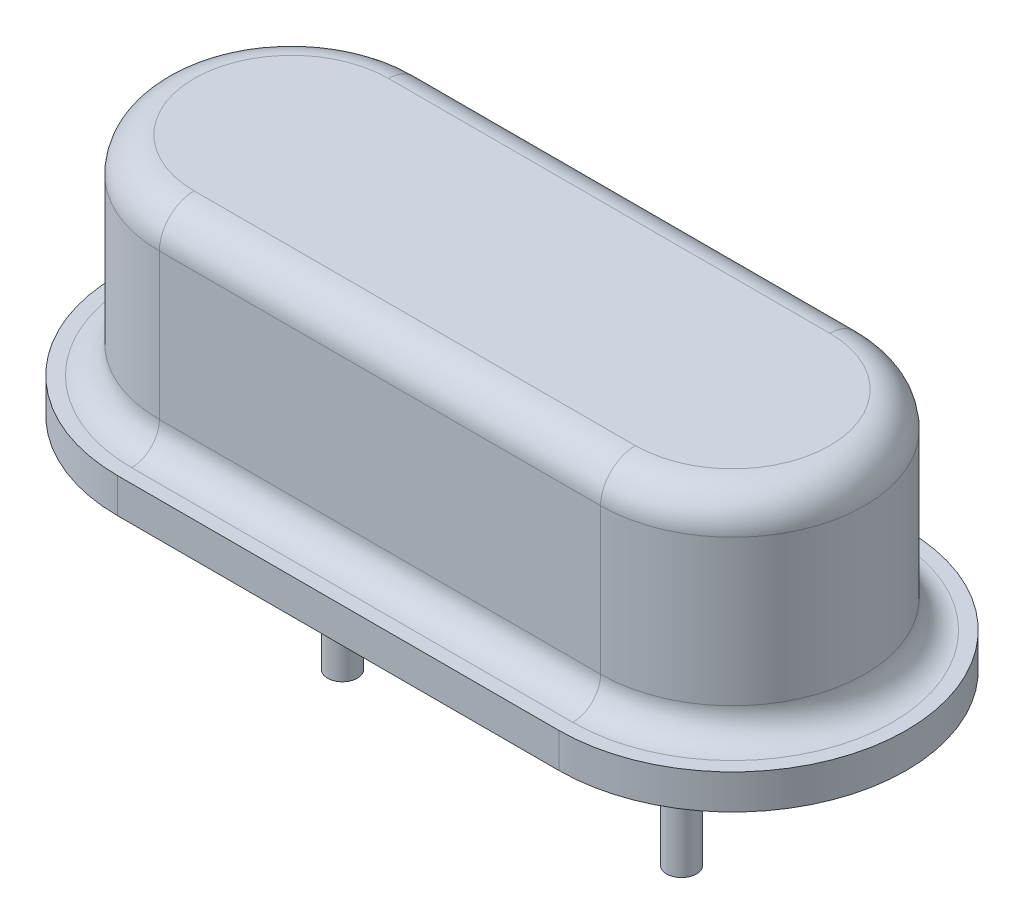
SolidWorks part; units mm, degrees
ref_plane "Front" through (0, 0, 0) normal (0, 0, 1) x (1, 0, 0)
ref_plane "Top" through (0, 0, 0) normal (0, 1, 0) x (1, 0, 0)
ref_plane "Right" through (0, 0, 0) normal (1, 0, 0) x (0, 0, -1)
sketch "Эскиз2" plane through (0, 0, 0) normal (0, 0, 1) x (1, 0, 0)
  line L0 (0, -2.5) -> (0.215, -2.5)
  line L1 (0.215, -2.5) -> (0.215, 0)
  line L2 (0.215, 0) -> (0.3127, 0)
  line L3 (0, -2.5) -> (0, 0) construction
  line L4 (0.7, 0.3) -> (0, 0.3)
  line L5 (0, 0.3) -> (0, -2.5)
  arc A0 (0.3127, 0) -> (0.7, 0.3) centre (0.3127, 0.4) ccw
  dimension "D4" = 0.4
  dimension "D1" = 0.43
  dimension "D2" = 2.5
  dimension "D3" = 0.3
  dimension "D5" = 1.4
revolve "Повернуть1" add sketch "Эскиз2" angle 360 about L3
sketch "Эскиз3" plane through (0, 0.3, 0) normal (0, 1, 0) x (-1, 0, 0)
  line L0 (0.735, 0) -> (-5.615, 0) construction
  line L1 (0.735, 2.5) -> (-5.615, 2.5)
  line L2 (0.735, -2.5) -> (-5.615, -2.5)
  line L3 (-2.44, -2.5) -> (-2.44, 2.5) construction
  arc A0 (0.735, 2.5) -> (0.735, -2.5) centre (0.735, 0) cw
  arc A1 (-5.615, 2.5) -> (-5.615, -2.5) centre (-5.615, 0) ccw
  dimension "D1" = 11.35
  dimension "D2" = 5
  dimension "D3" = 2.44
extrude "Вытянуть1" add sketch "Эскиз3" along normal blind 0.5
sketch "Эскиз4" plane through (0, 0.8, 0) normal (0, 1, 0) x (-1, 0, 0)
  line L4 (0.735, 1.9) -> (-5.615, 1.9)
  line L5 (-5.615, -1.9) -> (0.735, -1.9)
  line L6 (0.735, 1.9) -> (-5.615, 1.9)
  line L7 (-5.615, -1.9) -> (0.735, -1.9)
  arc A4 (-5.615, 1.9) -> (-5.615, -1.9) centre (-5.615, 0) ccw
  arc A5 (0.735, -1.9) -> (0.735, 1.9) centre (0.735, 0) ccw
  arc A6 (-5.615, 1.9) -> (-5.615, -1.9) centre (-5.615, 0) ccw
  arc A7 (0.735, -1.9) -> (0.735, 1.9) centre (0.735, 0) ccw
  dimension "D2" = 10.15
  dimension "D3" = 3.8
  dimension "D1" = 0.6
extrude "Вытянуть2" add sketch "Эскиз4" along normal offset from surface (3 mm away) 3.5
ref_plane "Плоскость1" through (2.44, 0, 0) normal (1, 0, 0) x (0, 0, -1)
mirror "Зеркальное отражение1" about plane through (2.44, 0, 0) normal (1, 0, 0) of "Повернуть1"
fillet "Скругление1" radius 0.4 4 edges at (-2.635, 0.8, 0) (2.44, 0.8, -1.9) (7.515, 0.8, 0) (2.44, 0.8, 1.9)
fillet "Скругление2" radius 0.5 4 edges at (7.515, 3.8, 0) (2.44, 3.8, -1.9) (-2.635, 3.8, 0) (2.44, 3.8, 1.9)
